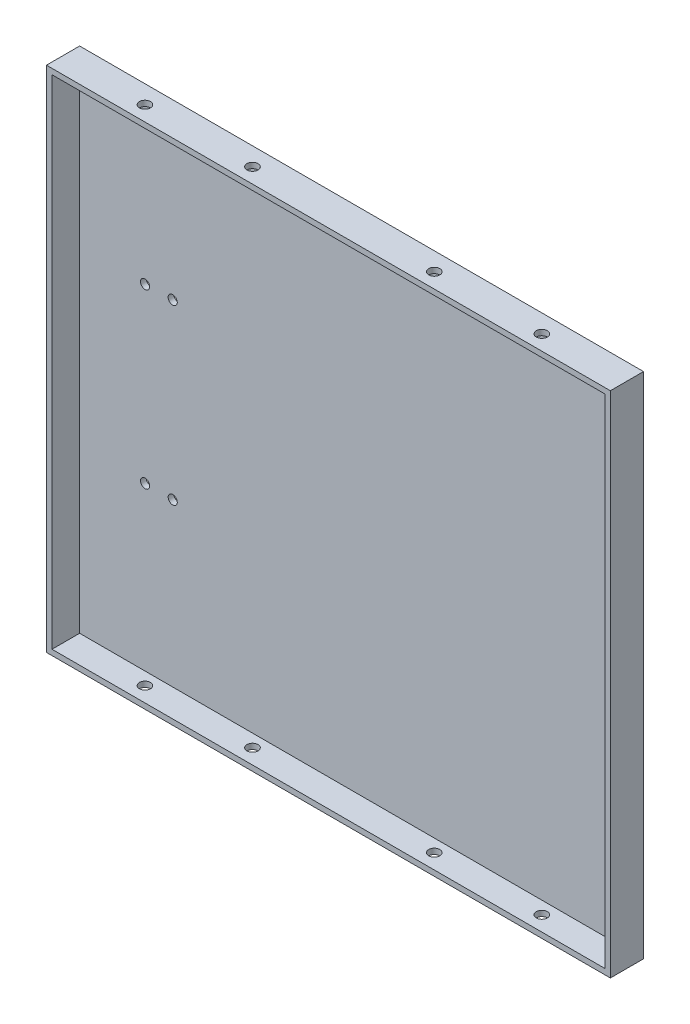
SolidWorks part; units mm, degrees
ref_plane "前视基准面" through (0, 0, 0) normal (0, 0, 1) x (1, 0, 0)
ref_plane "上视基准面" through (0, 0, 0) normal (0, 1, 0) x (1, 0, 0)
ref_plane "右视基准面" through (0, 0, 0) normal (1, 0, 0) x (0, 0, -1)
sketch "草图1" plane through (0, 0, 0) normal (0, 0, 1) x (1, 0, 0)
  line L1 (-102, 92) -> (102, 92)
  line L2 (-102, 92) -> (-102, -92)
  line L3 (-102, -92) -> (102, -92)
  line L4 (102, 92) -> (102, -92)
  line L5 (-102, 92) -> (102, -92) construction
  line L6 (-102, -92) -> (102, 92) construction
  point P0 (0, 0)
  dimension "D1" = 184
  dimension "D2" = 204
extrude "凸台-拉伸1" add sketch "草图1" along normal blind 12
sketch "草图2" plane through (0, 0, 12) normal (0, 0, 1) x (1, 0, 0)
  line L1 (-100, 90) -> (100, 90)
  line L2 (-100, 90) -> (-100, -90)
  line L3 (-100, -90) -> (100, -90)
  line L4 (100, 90) -> (100, -90)
  line L5 (-100, 90) -> (100, -90) construction
  line L6 (-100, -90) -> (100, 90) construction
  point P1 (0, 0)
  dimension "D1" = 200
  dimension "D2" = 180
extrude "切除-拉伸1" cut sketch "草图2" against normal blind 10 contours L2 L1 L4 L3
sketch "草图3" plane through (0, -92, 0) normal (0, -1, 0) x (1, 0, 0)
  line L0 (0, -6.6) -> (0, 6.6) construction
  circle A0 centre (-71.7935, 6.5844) radius 2
  circle A1 centre (-32.8832, 6.5844) radius 2
  circle A2 centre (32.8832, 6.5844) radius 2
  circle A3 centre (71.7935, 6.5844) radius 2
extrude "切除-拉伸2" cut sketch "草图3" against normal blind 10
mirror "镜向1" about plane through (0, 0, 0) normal (0, 1, 0) of "切除-拉伸2"
sketch "草图4" plane through (0, 0, 0) normal (0, 0, -1) x (-1, 0, 0)
  circle A0 centre (76.3281, -31.2) radius 1.65
  circle A1 centre (66.3286, -31.3) radius 1.65
  circle A2 centre (76.3281, 31.2) radius 1.65
  circle A3 centre (66.3286, 31.3) radius 1.65
extrude "切除-拉伸3" cut sketch "草图4" against normal blind 20
